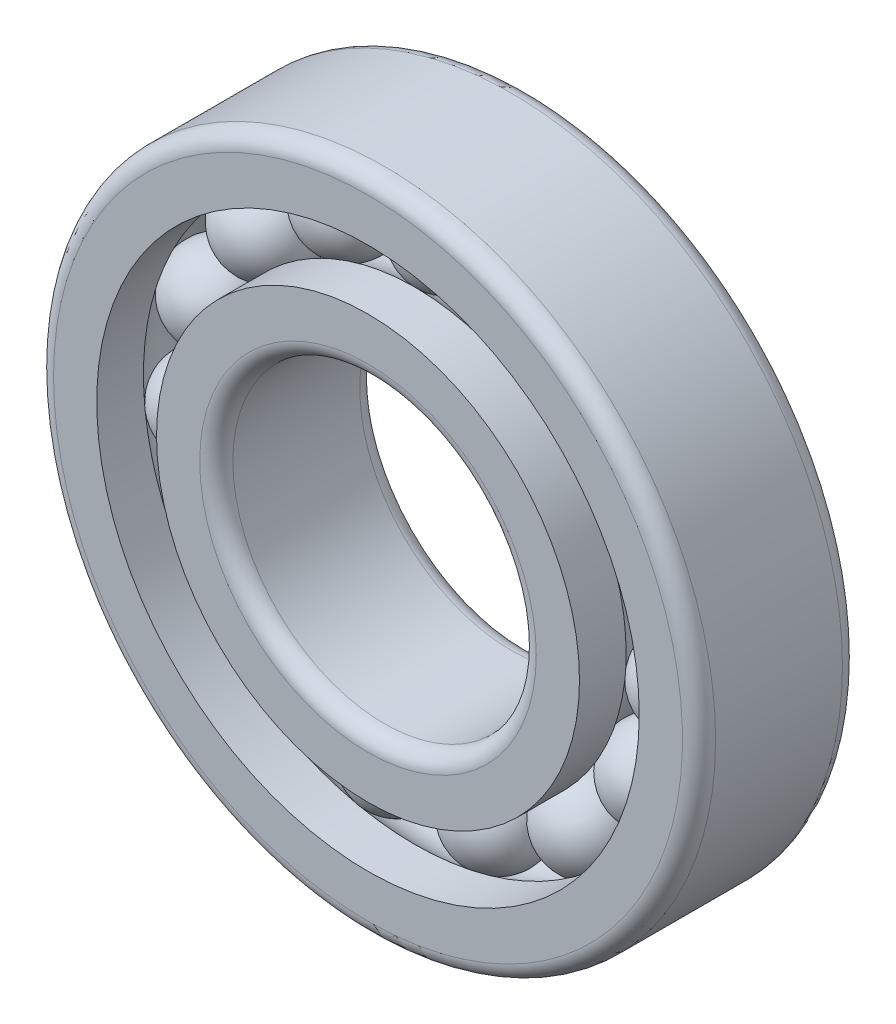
SolidWorks part; units mm, degrees
ref_plane "Front Plane" through (0, 0, 0) normal (0, 0, 1) x (1, 0, 0)
ref_plane "Top Plane" through (0, 0, 0) normal (0, 1, 0) x (1, 0, 0)
ref_plane "Right Plane" through (0, 0, 0) normal (1, 0, 0) x (0, 0, -1)
sketch "BaseSke" plane through (0, 0, 0) normal (1, 0, 0) x (0, 0, -1)
  line L0 (-47.2296, 0) -> (24.6132, 0) construction
  line L1 (-47.2296, 43.75) -> (24.6132, 43.75) construction
  line L2 (0, 129.5214) -> (0, -86.3012) construction
  line L3 (0, 51.875) -> (0, 35.625)
  line L4 (-14.5, 60) -> (14.5, 60) construction
  line L5 (-14.5, 27.5) -> (14.5, 27.5) construction
  arc A0 (0, 51.875) -> (0, 35.625) centre (0, 43.75) ccw
  dimension "Ball_diameter" = 16.25
  dimension "D1" = 43.75
  dimension "Bearing_Thickness" = 29
  dimension "Bearing_Outside_Diameter" = 120
  dimension "Bearing_Inside_Diameter" = 55
revolve "Ball" add sketch "BaseSke" angle 360 about L3
sketch "OuterRaceSke" plane through (0, 0, 0) normal (1, 0, 0) x (0, 0, -1)
  line L0 (0, 0) -> (0, 87.5396) construction
  line L1 (-14.5, 60) -> (14.5, 60)
  line L2 (-14.5, 60) -> (-14.5, 49.1667)
  line L3 (-14.5, 49.1667) -> (-6.0426, 49.1667)
  line L4 (14.5, 60) -> (14.5, 49.1667)
  line L5 (-50.3916, 0) -> (55.2197, 0) construction
  line L6 (-47.2296, 43.75) -> (24.6132, 43.75) construction
  line L7 (6.0426, 49.1667) -> (14.5, 49.1667)
  arc A0 (6.0426, 49.1667) -> (-6.0426, 49.1667) centre (0, 43.75) ccw
  dimension "D4" = 16.23
  dimension "D2" = 98.3333
revolve "OuterRace" add sketch "OuterRaceSke" angle 360 about L5
sketch "InnerRaceSke" plane through (0, 0, 0) normal (1, 0, 0) x (0, 0, -1)
  line L0 (-70.8626, 0) -> (113.5527, 0) construction
  line L1 (0, 58.441) -> (0, -70.8113) construction
  line L2 (-14.5, 27.5) -> (14.5, 27.5)
  line L3 (-14.5, 27.5) -> (-14.5, 38.3333)
  line L4 (-14.5, 38.3333) -> (-6.0426, 38.3333)
  line L5 (14.5, 27.5) -> (14.5, 38.3333)
  line L6 (0, 129.5214) -> (0, -86.3012) construction
  line L7 (6.0426, 38.3333) -> (14.5, 38.3333)
  arc A0 (-6.0426, 38.3333) -> (6.0426, 38.3333) centre (0, 43.75) ccw
  arc A1 (0, 51.875) -> (0, 35.625) centre (0, 43.75) ccw construction
  dimension "D2" = 16.23
  dimension "D1" = 76.6667
revolve "InnerRace" add sketch "InnerRaceSke" angle 360 about L0
fillet "Fillet1" radius 3 4 edges at (27.5, 0, -14.5) (27.5, 0, 14.5) (60, 0, -14.5) (60, 0, 14.5)
sketch "ShieldedSke" plane through (0, 0, 0) normal (1, 0, 0) x (0, 0, -1)
  line L1 (-13, 49.1667) -> (-9.6667, 49.1667)
  line L2 (-14.5, 47.6667) -> (-14.5, 39.8333)
  line L3 (-13, 38.3333) -> (-9.6667, 38.3333)
  line L4 (-9.6667, 49.1667) -> (-9.6667, 38.3333)
  arc A0 (-13, 49.1667) -> (-14.5, 47.6667) centre (-13, 47.6667) ccw
  arc A1 (-14.5, 39.8333) -> (-13, 38.3333) centre (-13, 39.8333) ccw
  point P12 (-14.5, 49.1667)
  point P13 (-14.5, 38.3333)
  dimension "D1" = 1.5
  dimension "D2" = 9.6667
revolve "Shielded" [suppressed] add sketch "ShieldedSke" angle 360 about L0
mirror "DoubleShielded" [suppressed] about plane through (0, 0, 0) normal (0, 0, 1)
sketch "SealedSke" plane through (0, 0, 0) normal (1, 0, 0) x (0, 0, -1)
  line L0 (-34.5153, 0) -> (39.09, 0) construction
  line L1 (-31.6, 38.3333) -> (-11.6, 38.3333)
  line L2 (-31.6, 38.3333) -> (-31.6, 49.1667)
  line L3 (-31.6, 49.1667) -> (-11.6, 49.1667)
  line L4 (-11.6, 38.3333) -> (-11.6, 49.1667)
  dimension "D1" = 20
  dimension "D2" = 11.6
revolve "Sealed" [suppressed] cut sketch "SealedSke" angle 360 about L0
mirror "DoubleSealed" [suppressed] about plane through (0, 0, 0) normal (0, 0, 1)
pattern_circular "CirPatternBall" count 15 over 360 about axis through (0, 0, 0) along (0, 0, 1) of "Ball"
sketch "CutGrooveSke" plane through (0, 0, 0) normal (1, 0, 0) x (0, 0, -1)
  line L0 (-51.8407, 0) -> (83.8302, 0) construction
  line L1 (8.7, -78.8) -> (7.25, -78.8)
  line L2 (8.7, -78.8) -> (8.7, -58.8)
  line L3 (8.7, -58.8) -> (7.25, -58.8)
  line L4 (7.25, -78.8) -> (7.25, -58.8)
  dimension "D1" = 58.8
  dimension "D2" = 7.25
  dimension "D3" = 1.45
  dimension "D4" = 20
revolve "CutGroove" [suppressed] cut sketch "CutGrooveSke" angle 360 about L0
sketch "TaperSke" plane through (0, 0, 0) normal (1, 0, 0) x (0, 0, -1)
  line L0 (-14.5, 27.5) -> (14.5, 27.5)
  line L1 (14.5, 27.5) -> (14.5, 29.9167)
  line L2 (14.5, 29.9167) -> (-14.5, 27.5)
  line L7 (-41.2502, 0) -> (40.8606, 0) construction
  dimension "Taper" = 2.4167
revolve "Taper" [suppressed] cut sketch "TaperSke" angle 360 about L7
fillet "Fillet2" [suppressed] radius 3
sketch "SimplifiedSke" plane through (0, 0, 0) normal (1, 0, 0) x (0, 0, -1)
  line L0 (37.5911, 0) -> (-37.5911, 0) construction
  circle A0 centre (0, 43.75) radius 8.125
  arc A1 (0, 51.875) -> (0, 35.625) centre (0, 43.75) ccw construction
revolve "Simplified" [suppressed] add sketch "SimplifiedSke" angle 360 about L0
equation "\"D1@BaseSke\" =  (\"Bearing_Outside_Diameter@BaseSke\"  +  \"Bearing_Inside_Diameter@BaseSke\"  )  / 4"
equation "\"Ball_diameter@BaseSke\" =  ( \"Bearing_Outside_Diameter@BaseSke\" - \"Bearing_Inside_Diameter@BaseSke\" ) / 4 "
equation "\"D2@OuterRaceSke\" = \"Bearing_Outside_Diameter@BaseSke\" -  ( \"Bearing_Outside_Diameter@BaseSke\" - \"Bearing_Inside_Diameter@BaseSke\" )  / 3"
equation "\"D4@OuterRaceSke\" = (  \"Bearing_Outside_Diameter@BaseSke\" - \"Bearing_Inside_Diameter@BaseSke\" ) / 4 -0.02"
equation "\"D1@InnerRaceSke\" = \"Bearing_Inside_Diameter@BaseSke\" +  ( \"Bearing_Outside_Diameter@BaseSke\" - \"Bearing_Inside_Diameter@BaseSke\" )  / 3"
equation "\"D2@InnerRaceSke\" = \"D4@OuterRaceSke\""
equation "\"D1@ShieldedSke\" = \"Fillet_radius@Fillet1\"/2"
equation "\"D2@ShieldedSke\" = \"Bearing_Thickness@BaseSke\"/3"
equation "\"D2@SealedSke\" = \"Bearing_Thickness@BaseSke\"/2.5"
equation "\"D1@CirPatternBall\" = int( \"D1@BaseSke\"* pi  * 2 / \"Ball_diameter@BaseSke\" ) -1"
equation "\"D1@CutGrooveSke\" = \"Bearing_Outside_Diameter@BaseSke\" * 0.49"
equation "\"D2@CutGrooveSke\" = \"Bearing_Thickness@BaseSke\" *0.25"
equation "\"D3@CutGrooveSke\" = \"Bearing_Thickness@BaseSke\"/20"
equation "\"Taper@TaperSke\" = \"Bearing_Thickness@BaseSke\"/12"
equation "\"D1@Fillet2\" = \"Fillet_radius@Fillet1\""
